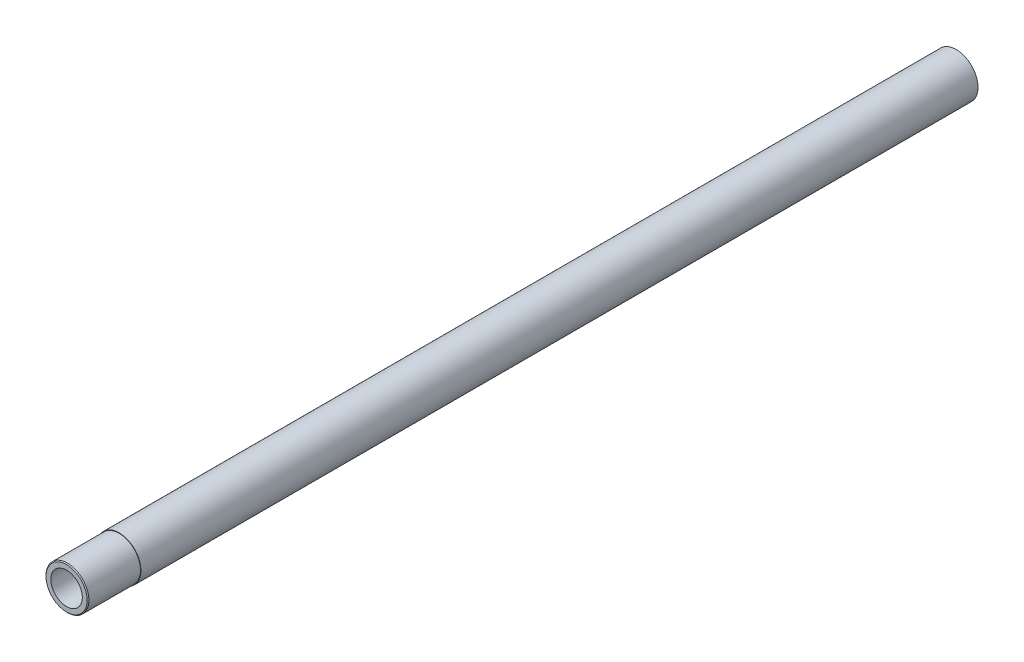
SolidWorks part; units mm, degrees
ref_plane "Piano frontale" through (0, 0, 0) normal (0, 0, 1) x (1, 0, 0)
ref_plane "Piano superiore" through (0, 0, 0) normal (0, 1, 0) x (1, 0, 0)
ref_plane "Piano destro" through (0, 0, 0) normal (1, 0, 0) x (0, 0, -1)
ref_plane "Piano1" through (0, 0, 0) normal (0, -1, 0) x (1, 0, 0)
sketch "Schizzo1" plane through (0, 0, 0) normal (0, -1, 0) x (1, 0, 0)
  line L0 (3.6, 203.3) -> (3.6, 181.3)
  line L1 (3.6, 181.3) -> (3.5, 181.3)
  line L2 (3.5, 181.3) -> (3.5, 0)
  line L3 (3.5, 0) -> (5, 0)
  line L4 (5, 0) -> (5, 191.3)
  line L5 (4.9, 203.3) -> (4.9, 191.3)
  line L6 (4.9, 203.3) -> (3.6, 203.3)
  line L7 (0, 290.3) -> (0, 0) construction
  line L8 (4.9, 191.3) -> (5, 191.3)
  dimension "D1" = 7
  dimension "D2" = 203.3
  dimension "D3" = 10
  dimension "D4" = 9.8
  dimension "D5" = 12
  dimension "D6" = 22
  dimension "D7" = 7.2
revolve "Rivoluzione1" add sketch "Schizzo1" angle 360 about L7
chamfer "Smusso1" distance 0.2 angle 45 1 edges at (-4.9, 0, 203.3)
